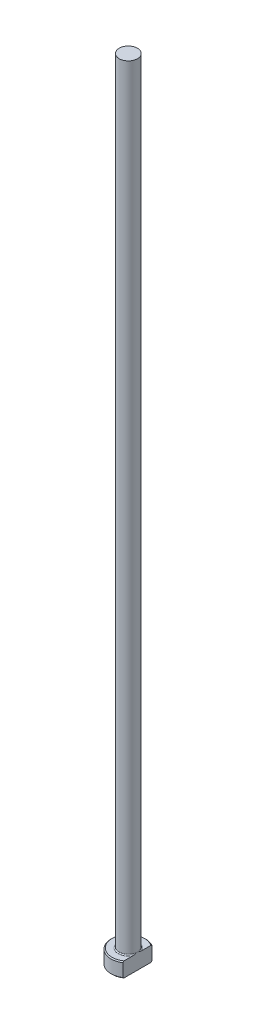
SolidWorks part; units mm, degrees
ref_plane "Front Plane" through (0, 0, 0) normal (0, 0, 1) x (1, 0, 0)
ref_plane "Top Plane" through (0, 0, 0) normal (0, 1, 0) x (1, 0, 0)
ref_plane "Right Plane" through (0, 0, 0) normal (1, 0, 0) x (0, 0, -1)
sketch "Sketch1" plane through (0, 0, 0) normal (0, 0, 1) x (1, 0, 0)
  line L0 (0, 259.9588) -> (0, -15.1925) construction
  line L1 (0, 0) -> (-3.5, 0)
  line L2 (-3.5, 0) -> (-3.5, 3)
  line L3 (-3.5, 3) -> (-1.85, 3)
  line L4 (-1.85, 3) -> (-1.85, 160)
  line L5 (-1.85, 160) -> (0, 160)
  line L6 (0, 160) -> (0, 0)
  dimension "L" = 160
  dimension "H" = 7
  dimension "T" = 3
  dimension "D" = 3.7
revolve "Revolve1" add sketch "Sketch1" angle 360 about L0
chamfer "Chamfer1" distance 0.2 angle 45 2 edges at (0, 3, 3.5) (0, 0, 3.5)
fillet "Fillet1" radius 0.2 1 edges at (0, 3, 1.85)
sketch "Sketch2" plane through (0, 0, 0) normal (0, 1, 0) x (1, 0, 0)
  line L0 (1.85, 2.9711) -> (1.85, -2.9711)
  circle A0 centre (0, 0) radius 3.5 construction
  arc A1 (1.85, -2.9711) -> (1.85, 2.9711) centre (0, 0) ccw
  circle A2 centre (0, 0) radius 1.85 construction
extrude "KEY" cut sketch "Sketch2" along normal through all
